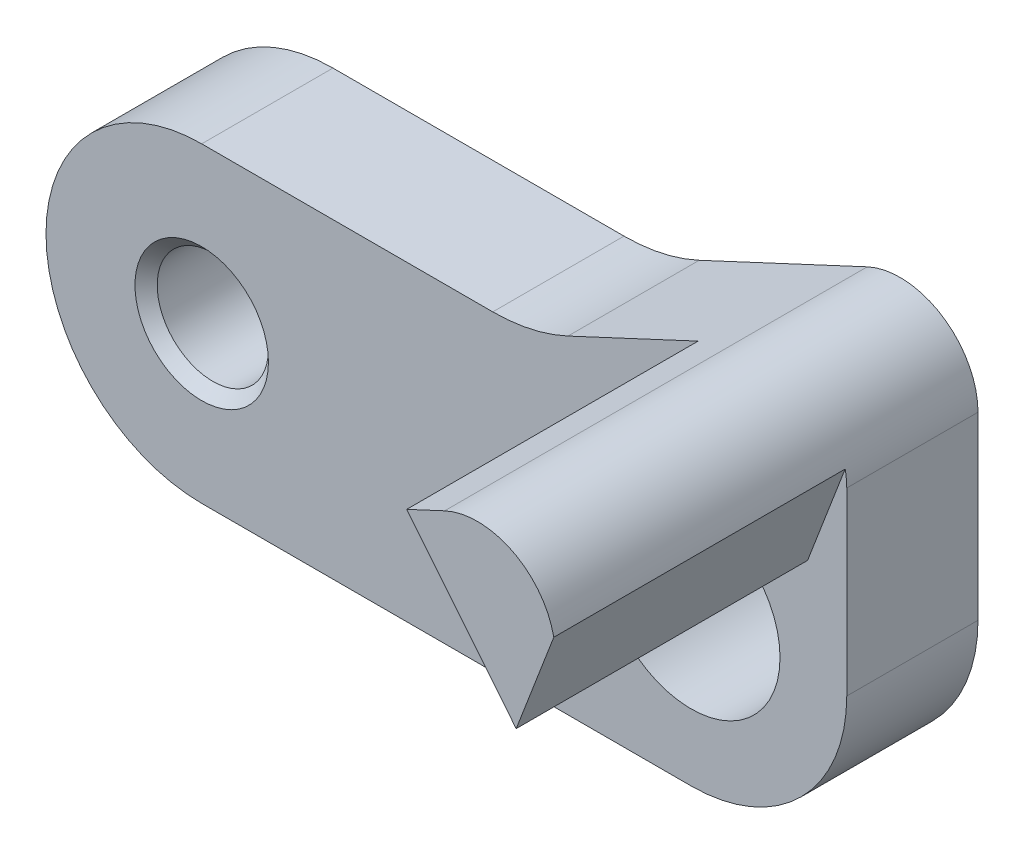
SolidWorks part; units mm, degrees
ref_plane "Face" through (0, 0, 0) normal (0, 0, 1) x (1, 0, 0)
ref_plane "Dessus" through (0, 0, 0) normal (0, 1, 0) x (1, 0, 0)
ref_plane "Droite" through (0, 0, 0) normal (1, 0, 0) x (0, 0, -1)
sketch "Esquisse1" plane through (0, 0, 0) normal (0, 0, 1) x (1, 0, 0)
  line L0 (3.5, 0) -> (3.5, 4.05)
  line L1 (0, -3.5) -> (-11, -3.5)
  line L2 (-11, 17.3873) -> (-11, -12.0489) construction
  line L3 (-21.0651, 0) -> (-4.2837, 0) construction
  line L4 (-11, 3.5) -> (-4.4571, 3.5)
  line L5 (-2.7666, 3.8748) -> (1.0104, 5.636)
  arc A0 (0, -3.5) -> (3.5, 0) centre (0, 0) ccw
  arc A1 (-11, 3.5) -> (-11, -3.5) centre (-11, 0) ccw
  arc A2 (1.0104, 5.636) -> (3.5, 4.05) centre (1.75, 4.05) cw
  arc A3 (-4.4571, 3.5) -> (-2.7666, 3.8748) centre (-4.4571, 7.5) ccw
  dimension "D1" = 7
  dimension "D5" = 1.75
  dimension "D6" = 4
  dimension "D2" = 11
  dimension "D3" = 3.5
  dimension "D4" = 155
  dimension "D7" = 4.05
  dimension "D8" = 7
extrude "Extrusion1" add sketch "Esquisse1" along normal blind 2.95
sketch "Esquisse2" plane through (0, 0, 2.95) normal (0, 0, 1) x (1, 0, 0)
  line L0 (0.1585, 5.2388) -> (2.6192, 2.2)
  line L1 (0, 0) -> (-7.3979, 0) construction
  line L2 (2.6192, 2.2) -> (3.4643, 4.4016)
  line L3 (1.0104, 5.636) -> (-2.7666, 3.8748) construction
  line L4 (1.0104, 5.636) -> (0.1585, 5.2388)
  arc A0 (3.5, 4.05) -> (1.0104, 5.636) centre (1.75, 4.05) ccw construction
  arc A1 (3.4643, 4.4016) -> (1.0104, 5.636) centre (1.75, 4.05) ccw
  dimension "D1" = 51
  dimension "D2" = 3.42
  dimension "D3" = 60
  dimension "D4" = 2.2
extrude "Extrusion2" add sketch "Esquisse2" along normal blind 6.55
sketch "Esquisse3" plane through (0, 0, 2.95) normal (0, 0, 1) x (1, 0, 0)
  circle A0 centre (0, 0) radius 2
  dimension "D1" = 4
extrude "Enlèv. mat.-Extru.1" cut sketch "Esquisse3" against normal blind 6.55
hole_wizard "Trou taraudé M3x0.54" positions "Esquisse3D6" profile "Esquisse9" tap size "M3x0.5" standard "ISO"
sketch3d "Esquisse3D6"
  arc A0 (-11, 3.5, 2.95) -> (-11, -3.5, 2.95) centre (-11, 0, 2.95) ccw construction
  point P0 (-11, 0, 2.95)
  point P10 (-11, 0, 6.45)
sketch "Esquisse9" plane through (-11, 0, 2.95) normal (1, 0, 0) x (0, -1, 0)
  line L0 (0, 0) -> (0, 2.95)
  line L1 (0, 2.95) -> (1.5, 2.95)
  line L2 (1.25, 2.7) -> (1.25, 0.25)
  line L3 (1.25, 0.25) -> (1.5, 0)
  line L5 (1.5, 0) -> (0, 0)
  line L6 (-1.25, 0.25) -> (-1.5, 0) construction
  line L7 (1.5, 2.95) -> (1.25, 2.7)
  line L8 (-1.5, 2.95) -> (-1.25, 2.7) construction
  line L11 (0, -6.35) -> (0, 107.95) construction
  dimension "Diamètre du trou pour taraudage jusqu'au prochain" = 2.5
  dimension "Profondeur du trou pour taraudage jusqu'au prochain" = 2.95
  dimension "Diamètre du fraisage entrant" = 3
  dimension "Angle du fraisage entrant" = 90
  dimension "Diamètre du fraisage débouchant" = 3
  dimension "Angle du fraisage débouchant" = 90
